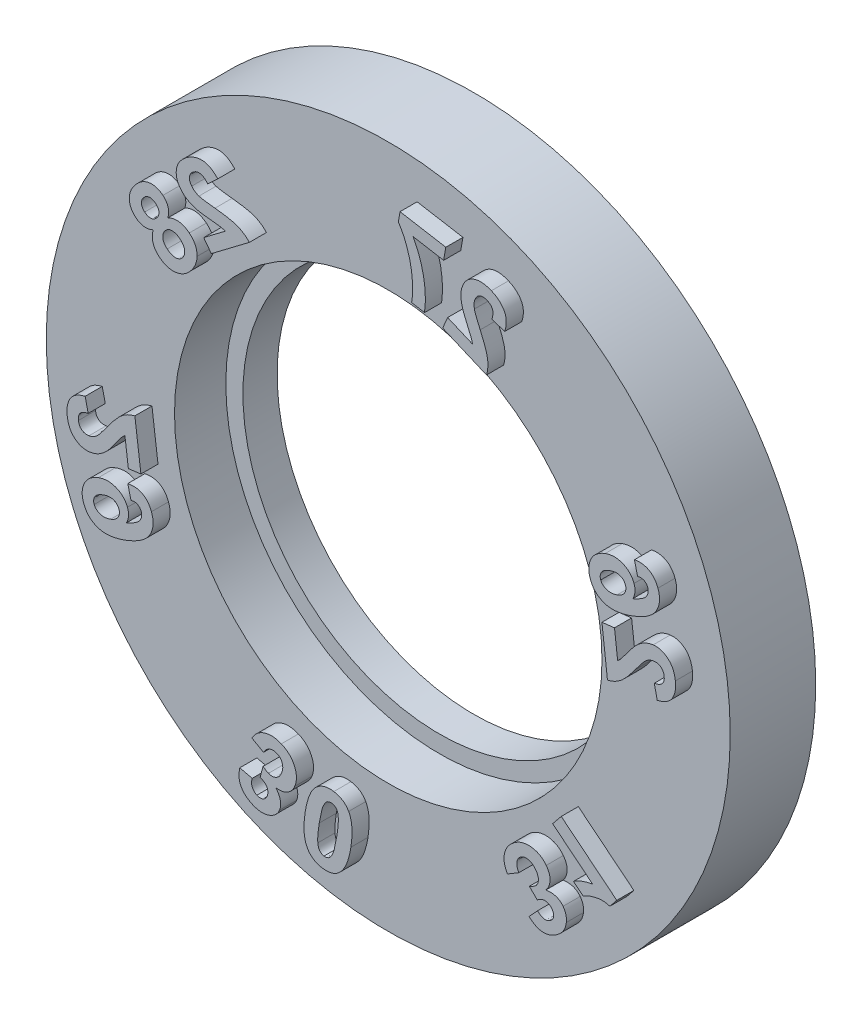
SolidWorks part; units mm, degrees
ref_plane "Front Plane" through (0, 0, 0) normal (0, 0, 1) x (1, 0, 0)
ref_plane "Top Plane" through (0, 0, 0) normal (0, 1, 0) x (1, 0, 0)
ref_plane "Right Plane" through (0, 0, 0) normal (1, 0, 0) x (0, 0, -1)
imported_body "Imported1"
other "DeleteFace2"
sketch "Sketch2" plane through (0, 0, 0) normal (0, 0, 1) x (1, 0, 0)
  line L2 (0, 0) -> (0, 21.375) construction
  line L3 (0, 0) -> (18.5113, 10.6875) construction
  line L4 (0, 0) -> (18.5113, -10.6875) construction
  line L5 (0, 0) -> (0, -21.375) construction
  line L6 (0, 0) -> (-18.5113, -10.6875) construction
  line L7 (0, 0) -> (-18.5113, 10.6875) construction
  circle A0 centre (0, 0) radius 13.8372 construction
  text T0 "26     27     28     29     30     31" font "Arial" height 4.2
  point P11 (0, 0)
  dimension "D1" = 6
extrude "Boss-Extrude1" add sketch "Sketch2" along normal blind 1
